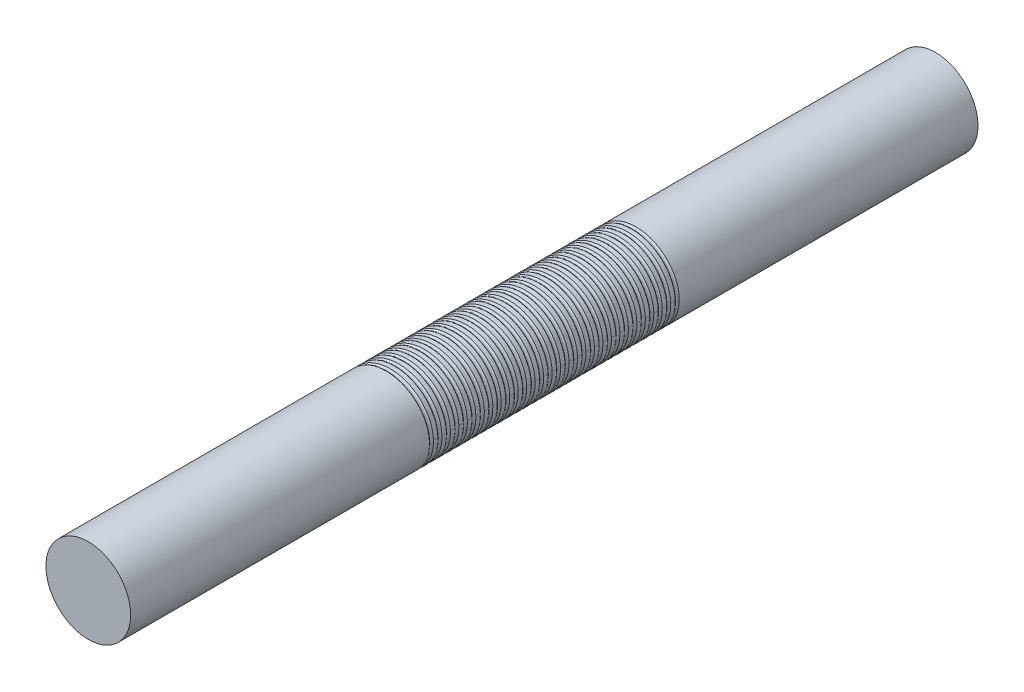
SolidWorks part; units mm, degrees
ref_plane "Front Plane" through (0, 0, 0) normal (0, 0, 1) x (1, 0, 0)
ref_plane "Top Plane" through (0, 0, 0) normal (0, 1, 0) x (1, 0, 0)
ref_plane "Right Plane" through (0, 0, 0) normal (1, 0, 0) x (0, 0, -1)
sketch "Sketch1" plane through (0, 0, 0) normal (0, 0, 1) x (1, 0, 0)
  circle A0 centre (0, 0) radius 25
  dimension "D1" = 50
extrude "Boss-Extrude1" add sketch "Sketch1" along normal blind 500
ref_plane "Plane1" through (0, 0, 175) normal (0, 0, 1) x (1, 0, 0)
sketch "Sketch2" plane through (0, 0, 175) normal (0, 0, 1) x (1, 0, 0)
  circle A0 centre (0, 0) radius 26.06
  dimension "D1" = 52.12
curve "Helix/Spiral1"
sketch "Sketch3" plane through (0, 0, 0) normal (0, 1, 0) x (1, 0, 0)
  circle A0 centre (-26.06, -175) radius 1.59
  spline S0 degree 3 number of poles 681 (-26.06, -175) -> (-26.06, -325) construction
  dimension "D1" = 3.18
sweep "Cut-Sweep1" cut profiles "Sketch3" path "Helix/Spiral1"
pattern_linear "LPattern1" [suppressed] count 2 spacing 500
